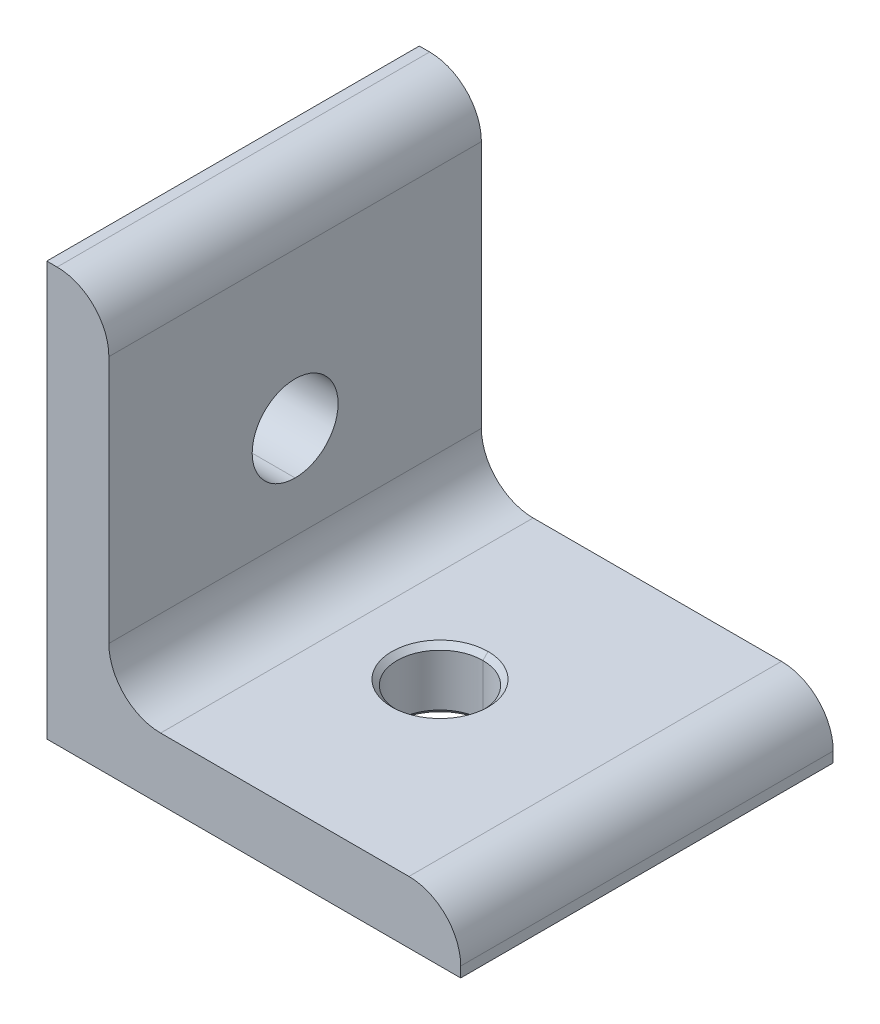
SolidWorks part; units mm, degrees
ref_plane "Front Plane" through (0, 0, 0) normal (0, 0, 1) x (1, 0, 0)
ref_plane "Top Plane" through (0, 0, 0) normal (0, 1, 0) x (1, 0, 0)
ref_plane "Right Plane" through (0, 0, 0) normal (1, 0, 0) x (0, 0, -1)
ref_plane "RIGHT" through (0, 0, 0) normal (1, 0, 0) x (0, 1, 0)
ref_plane "TOP" through (0, 0, 0) normal (0, 1, 0) x (0, 0, 1)
ref_plane "FRONT" through (0, 0, 0) normal (0, 0, 1) x (1, 0, 0)
imported_body "Imported1"
scale "Scale1" scale about centroid uniform scaling yes scale factor 0.03937
